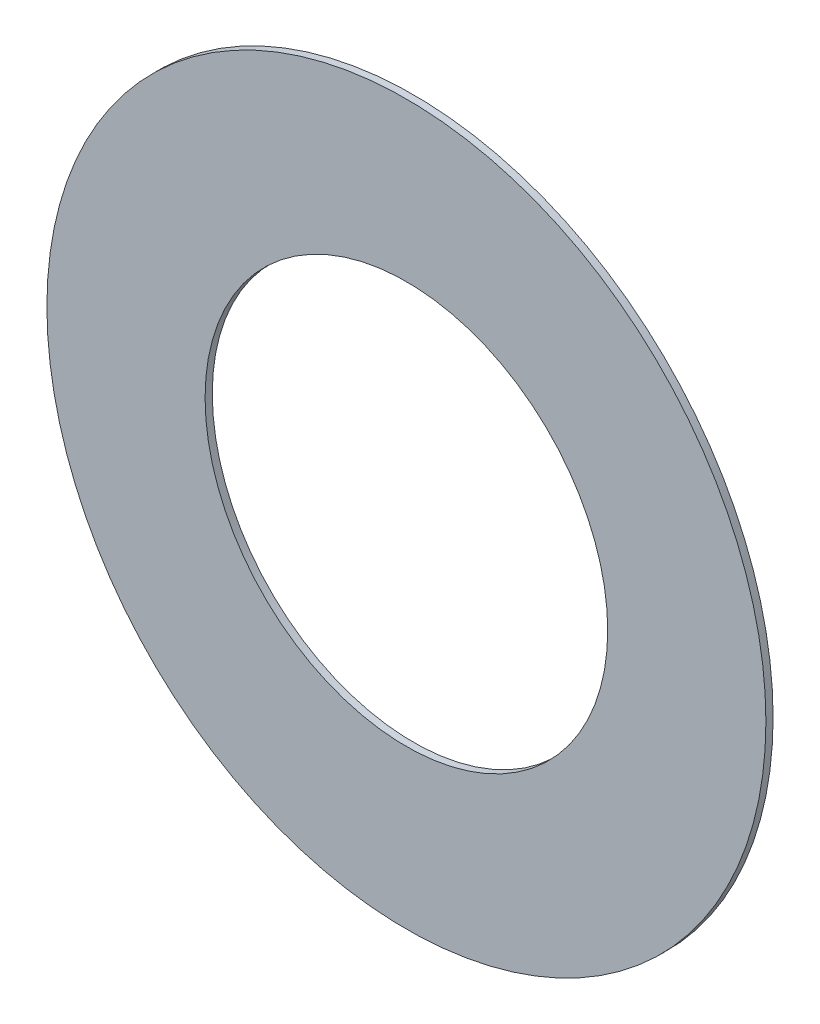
SolidWorks part; units mm, degrees
ref_plane "Plan de face" through (0, 0, 0) normal (0, 0, 1) x (1, 0, 0)
ref_plane "Plan de dessus" through (0, 0, 0) normal (0, 1, 0) x (1, 0, 0)
ref_plane "Plan de droite" through (0, 0, 0) normal (1, 0, 0) x (0, 0, -1)
sketch "Esquisse1" plane through (0, 0, 0) normal (0, 0, 1) x (1, 0, 0)
  circle A0 centre (0, 0) radius 37.5
  circle A1 centre (0, 0) radius 21
  dimension "D1" = 75
  dimension "D2" = 42
extrude "Extrusion1" add sketch "Esquisse1" along normal blind 0.75
